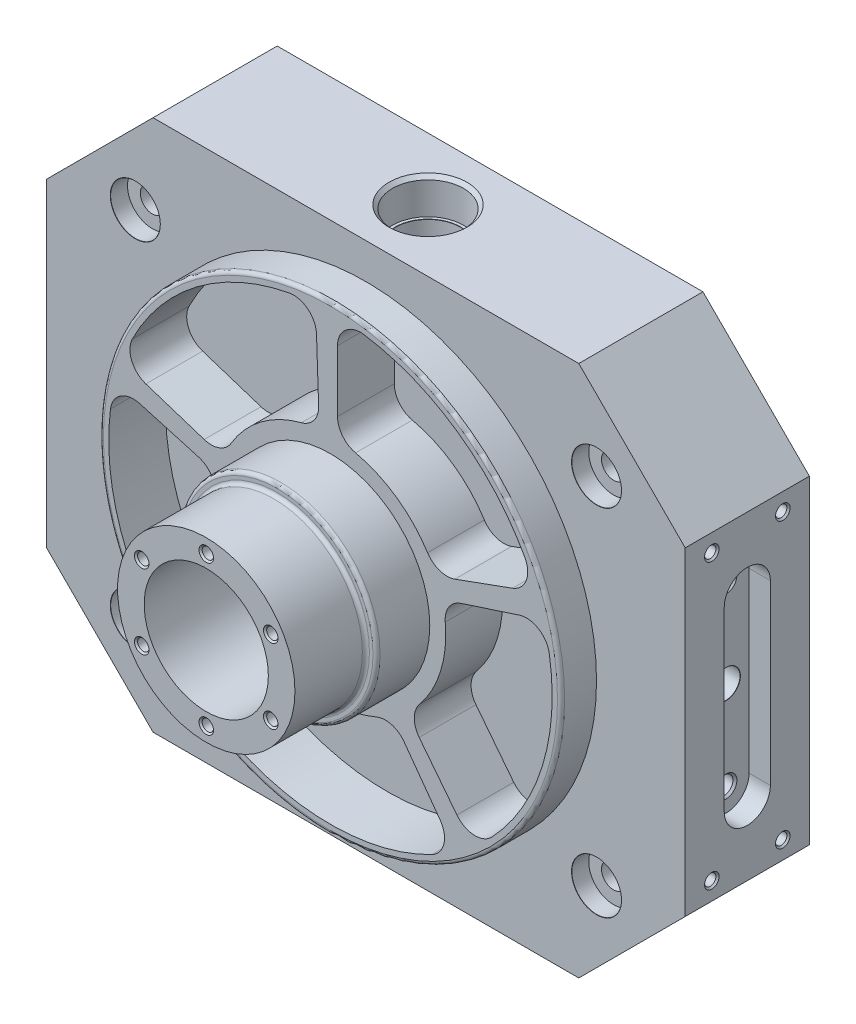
SolidWorks part; units mm, degrees
ref_plane "Front Plane" through (0, 0, 0) normal (0, 0, 1) x (1, 0, 0)
ref_plane "Top Plane" through (0, 0, 0) normal (0, 1, 0) x (1, 0, 0)
ref_plane "Right Plane" through (0, 0, 0) normal (1, 0, 0) x (0, 0, -1)
sketch "Sketch1" plane through (0, 0, 0) normal (0, 0, 1) x (1, 0, 0)
  line L0 (30, -37.5) -> (45, -22.5)
  line L1 (-30, 37.5) -> (30, 37.5)
  line L2 (-45, 22.5) -> (-45, -22.5)
  line L3 (-30, -37.5) -> (30, -37.5)
  line L4 (45, 22.5) -> (45, -22.5)
  line L5 (-45, 37.5) -> (45, -37.5) construction
  line L6 (-45, -37.5) -> (45, 37.5) construction
  line L7 (30, 37.5) -> (45, 22.5)
  line L8 (-45, 22.5) -> (-30, 37.5)
  line L9 (-45, -22.5) -> (-30, -37.5)
  point P0 (0, 0)
  dimension "D1" = 90
  dimension "D2" = 75
  dimension "D3" = 15
  dimension "D4" = 45
  dimension "D5" = 15
  dimension "D6" = 45
  dimension "D7" = 15
  dimension "D8" = 45
  dimension "D9" = 15
  dimension "D10" = 45
extrude "Boss-Extrude1" add sketch "Sketch1" along normal blind 17.5
sketch "Sketch2" plane through (0, 0, 17.5) normal (0, 0, 1) x (1, 0, 0)
  circle A0 centre (0, 0) radius 32.5
  dimension "D1" = 65
extrude "Boss-Extrude2" add sketch "Sketch2" along normal blind 5
sketch "Sketch3" plane through (0, 0, 22.5) normal (0, 0, 1) x (1, 0, 0)
  circle A0 centre (0, 0) radius 14
  dimension "D1" = 28
extrude "Boss-Extrude3" add sketch "Sketch3" along normal blind 7.5
sketch "Sketch4" plane through (0, 0, 30) normal (0, 0, 1) x (1, 0, 0)
  circle A0 centre (0, 0) radius 12.5
  dimension "D1" = 25
extrude "Boss-Extrude4" add sketch "Sketch4" along normal blind 10
sketch "Sketch5" plane through (0, 0, 40) normal (0, 0, 1) x (1, 0, 0)
  circle A0 centre (0, 0) radius 8.75
  dimension "D1" = 17.5
extrude "Cut-Extrude3" cut sketch "Sketch5" against normal through all
fillet "Fillet2" radius 0.5 1 edges at (32.5, 0, 22.5)
fillet "Fillet3" radius 0.5 2 edges at (12.5, 0, 30) (14, 0, 30)
sketch "Sketch6" plane through (0, 0, 22.5) normal (0, 0, 1) x (1, 0, 0)
  line L0 (0, 0) -> (0, 32) construction
  line L1 (1, 16.2192) -> (1, 31.234)
  line L2 (0, 0) -> (77.5446, 28.2239) construction
  line L4 (1, 0) -> (1, 32) construction
  line L5 (14.899, 6.487) -> (29.0083, 11.6223)
  circle A0 centre (0, 0) radius 32 construction
  arc A1 (14.899, 6.487) -> (1, 16.2192) centre (0, 0) ccw
  arc A2 (29.0083, 11.6223) -> (1, 31.234) centre (0, 0) ccw
  dimension "D2" = 62.5
  dimension "D3" = 32.5
  dimension "D1" = 1
  dimension "D5" = 1
  dimension "D4" = 70
extrude "Cut-Extrude4" cut sketch "Sketch6" against normal blind 8
fillet "Fillet4" radius 3.25 4 edges at (1, 16.2192, 18.5) (14.899, 6.487, 18.5) (29.0083, 11.6223, 18.5) (1, 31.234, 18.5)
pattern_circular "CirPattern2" count 5 over 360 about axis through (0, 0, 0) along (0, 0, 1) of "Cut-Extrude4", "Fillet4"
hole_wizard "CBORE for M3 Pan Head Machine Screw1" positions "Sketch7" profile "Sketch8" counterbore size "M3" standard "ANSI Metric"
sketch "Sketch7" plane through (0, 0, 17.5) normal (0, 0, 1) x (1, 0, 0)
  line L0 (0, 0) -> (-45, 0) construction
  line L1 (-45, 22.5) -> (-45, -22.5) construction
  line L2 (0, 0) -> (0, -37.5) construction
  line L3 (-30, -37.5) -> (30, -37.5) construction
  point P0 (-32.5, -25)
  point P16 (-32.5, 25)
  point P18 (32.5, -25)
  point P19 (32.5, 25)
  dimension "D1" = 25
  dimension "D2" = 32.5
sketch "Sketch8" plane through (-32.5, -25, 17.5) normal (1, 0, 0) x (0, -1, 0)
  line L0 (0, 0) -> (0, 17.5)
  line L1 (0, 17.5) -> (1.7, 17.5)
  line L3 (1.7, 17.5) -> (1.7, 2.4)
  line L4 (3.5, 2.4) -> (1.7, 2.4)
  line L5 (3.5, 2.4) -> (3.5, 0.025)
  line L6 (3.5, 0.025) -> (3.525, 0)
  line L7 (3.525, 0) -> (0, 0)
  line L8 (-3.5, 0.025) -> (-3.525, 0) construction
  line L11 (0, -6.35) -> (0, 107.95) construction
  dimension "Thru Hole Dia." = 3.4
  dimension "Thru Hole Depth" = 17.5
  dimension "C'Bore Dia." = 7
  dimension "C'Bore Depth" = 2.4
  dimension "Near C'Sink Dia." = 7.05
  dimension "Near C'Sink Angle" = 90
hole_wizard "M2x0.4 Tapped Hole1" positions "Sketch9" profile "Sketch10" tap size "M2x0.4" standard "ANSI Metric"
sketch "Sketch9" plane through (0, 0, 40) normal (0, 0, 1) x (1, 0, 0)
  line L0 (0, 0) -> (0, 10.5) construction
  point P0 (0, 10.5)
  point P32 (9.0933, 5.25)
  point P33 (9.0933, -5.25)
  point P34 (0, -10.5)
  point P35 (-9.0933, -5.25)
  point P36 (-9.0933, 5.25)
  dimension "D1" = 10.5
sketch "Sketch10" plane through (0, 10.5, 40) normal (1, 0, 0) x (0, -1, 0)
  line L0 (0, 0) -> (0, 6.4807)
  line L1 (0, 6.4807) -> (0.8, 6)
  line L2 (0.8, 6) -> (0.8, 0.225)
  line L3 (0.8, 0.225) -> (1.025, 0)
  line L5 (1.025, 0) -> (0, 0)
  line L6 (-0.8, 0.225) -> (-1.025, 0) construction
  line L10 (0, 6.4807) -> (-0.8, 6) construction
  line L11 (0, -6.35) -> (0, 107.95) construction
  dimension "Tap Drill Dia." = 1.6
  dimension "Tap Drill Depth" = 6
  dimension "Near C'Sink Dia." = 2.05
  dimension "Near C'Sink Angle" = 90
  dimension "Drill Angle" = 118
sketch "Sketch11" plane through (-45, 0, 0) normal (-1, 0, 0) x (0, 0, 1)
  line L0 (0, 0) -> (17.5, 0) construction
  line L1 (17.5, -32.5) -> (17.5, 32.5) construction
  line L2 (8.75, -12.5) -> (8.75, 12.5) construction
  line L3 (5.5, -12.5) -> (5.5, 12.5)
  line L4 (12, -12.5) -> (12, 12.5)
  arc A0 (5.5, -12.5) -> (12, -12.5) centre (8.75, -12.5) ccw
  arc A1 (12, 12.5) -> (5.5, 12.5) centre (8.75, 12.5) ccw
  point P7 (8.75, 0)
  dimension "D1" = 3.25
  dimension "D2" = 25
extrude "Cut-Extrude5" cut sketch "Sketch11" against normal blind 3
hole_wizard "M3x0.5 Tapped Hole1" positions "Sketch12" profile "Sketch13" tap size "M3x0.5" standard "ANSI Metric"
sketch "Sketch12" plane through (-42, 0, 0) normal (-1, 0, 0) x (0, 0, 1)
  point P0 (8.75, -12.5)
  point P3 (8.75, 12.5)
sketch "Sketch13" plane through (-42, -12.5, 8.75) normal (0, 1, 0) x (0, 0, 1)
  line L0 (0, 0) -> (0, 9.2511)
  line L1 (0, 9.2511) -> (1.25, 8.5)
  line L2 (1.25, 8.5) -> (1.25, 0.275)
  line L3 (1.25, 0.275) -> (1.525, 0)
  line L5 (1.525, 0) -> (0, 0)
  line L6 (-1.25, 0.275) -> (-1.525, 0) construction
  line L10 (0, 9.2511) -> (-1.25, 8.5) construction
  line L11 (0, -6.35) -> (0, 107.95) construction
  dimension "Tap Drill Dia." = 2.5
  dimension "Tap Drill Depth" = 8.5
  dimension "Near C'Sink Dia." = 3.05
  dimension "Near C'Sink Angle" = 90
  dimension "Drill Angle" = 118
hole_wizard "Ø4.0mm Dowel Hole1" positions "Sketch14" profile "Sketch15" hole size "Ø4.0" standard "ANSI Metric"
sketch "Sketch14" plane through (-42, 0, 0) normal (-1, 0, 0) x (0, 0, 1)
  line L0 (5.5, 0) -> (12, 0) construction
  line L1 (5.5, 12.5) -> (5.5, -12.5) construction
  line L2 (12, -12.5) -> (12, 12.5) construction
  point P8 (8.75, 0)
sketch "Sketch15" plane through (-42, 0, 8.75) normal (0, 1, 0) x (0, 0, 1)
  line L0 (0, 0) -> (0, 18.2017)
  line L1 (0, 18.2017) -> (2, 17)
  line L2 (2, 17) -> (2, 0.025)
  line L3 (2, 0.025) -> (2.025, 0)
  line L5 (2.025, 0) -> (0, 0)
  line L6 (-2, 0.025) -> (-2.025, 0) construction
  line L10 (0, 18.2017) -> (-2, 17) construction
  line L11 (0, -6.35) -> (0, 107.95) construction
  dimension "Hole Dia." = 4
  dimension "Hole Depth" = 17
  dimension "Near C'Sink Dia." = 4.05
  dimension "Near C'Sink Angle" = 90
  dimension "Drill Angle" = 118
hole_wizard "M2x0.4 Tapped Hole2" positions "Sketch18" profile "Sketch17" tap size "M2x0.4" standard "ANSI Metric"
sketch "Sketch18" plane through (-45, 0, 0) normal (-1, 0, 0) x (0, 0, 1)
  line L0 (0, 0) -> (17.5, 0) construction
  line L1 (17.5, 22.5) -> (17.5, -22.5) construction
  line L2 (8.75, 0) -> (8.75, 22.5) construction
  line L3 (17.5, 22.5) -> (0, 22.5) construction
  point P0 (3.75, -20)
  point P15 (3.75, 20)
  point P17 (13.75, -20)
  point P18 (13.75, 20)
  dimension "D1" = 20
  dimension "D2" = 5
sketch "Sketch17" plane through (-45, -20, 3.75) normal (0, 1, 0) x (0, 0, 1)
  line L0 (0, 0) -> (0, 6.4807)
  line L1 (0, 6.4807) -> (0.8, 6)
  line L2 (0.8, 6) -> (0.8, 0.225)
  line L3 (0.8, 0.225) -> (1.025, 0)
  line L5 (1.025, 0) -> (0, 0)
  line L6 (-0.8, 0.225) -> (-1.025, 0) construction
  line L10 (0, 6.4807) -> (-0.8, 6) construction
  line L11 (0, -6.35) -> (0, 107.95) construction
  dimension "Tap Drill Dia." = 1.6
  dimension "Tap Drill Depth" = 6
  dimension "Near C'Sink Dia." = 2.05
  dimension "Near C'Sink Angle" = 90
  dimension "Drill Angle" = 118
mirror "Mirror1" about plane through (0, 0, 0) normal (1, 0, 0) of "M2x0.4 Tapped Hole2", "Ø4.0mm Dowel Hole1", "M3x0.5 Tapped Hole1", "Cut-Extrude5"
sketch "Sketch19" plane through (0, -37.5, 0) normal (0, -1, 0) x (1, 0, 0)
  line L0 (0, 17.5) -> (0, 0) construction
  line L1 (-30, 17.5) -> (30, 17.5) construction
  circle A0 centre (0, 8.75) radius 5
  dimension "D1" = 10
extrude "Cut-Extrude6" cut sketch "Sketch19" against normal blind 5
chamfer "Chamfer1" distance 0.5 angle 45 1 edges at (0, -37.5, 3.75)
hole_wizard "1/8 Rc Tapped Hole1" positions "Sketch21" profile "Sketch22" size "1/8" standard "DIN"
sketch "Sketch21" plane through (0, -32.5, 0) normal (0, -1, 0) x (-1, 0, 0)
  point P0 (0, -8.75)
sketch "Sketch22" plane through (0, -32.5, 8.75) normal (1, 0, 0) x (0, 0, -1)
  line L0 (0, 0) -> (0, 23.75)
  line L1 (0, 23.75) -> (3.95, 23.75)
  line L3 (3.95, 23.75) -> (3.95, 7.4)
  line L4 (3.95, 7.4) -> (4.3433, 7.4)
  line L5 (4.3433, 7.4) -> (4.5735, 0.025)
  line L6 (4.5735, 0.025) -> (4.5985, 0)
  line L7 (4.5985, 0) -> (0, 0)
  line L8 (0, -6.35) -> (0, 107.95) construction
  line L9 (-4.5735, 0.025) -> (-4.5985, 0) construction
  line L11 (-3.95, 7.4) -> (-4.3433, 7.4) construction
  line L12 (-4.3433, 7.4) -> (-4.5735, 0.025) construction
  dimension "Thru Tap Drill Dia." = 7.9
  dimension "Thru Tap Drill Depth" = 23.75
  dimension "Thread Dia." = 9.147
  dimension "Thread Angle" = 3.576
  dimension "Thread Depth" = 7.4
  dimension "Near C'Sink Dia." = 9.197
  dimension "Near C'Sink Angle" = 90
mirror "Mirror5" about plane through (0, 0, 0) normal (0, 1, 0) of "1/8 Rc Tapped Hole1", "Chamfer1", "Cut-Extrude6"
